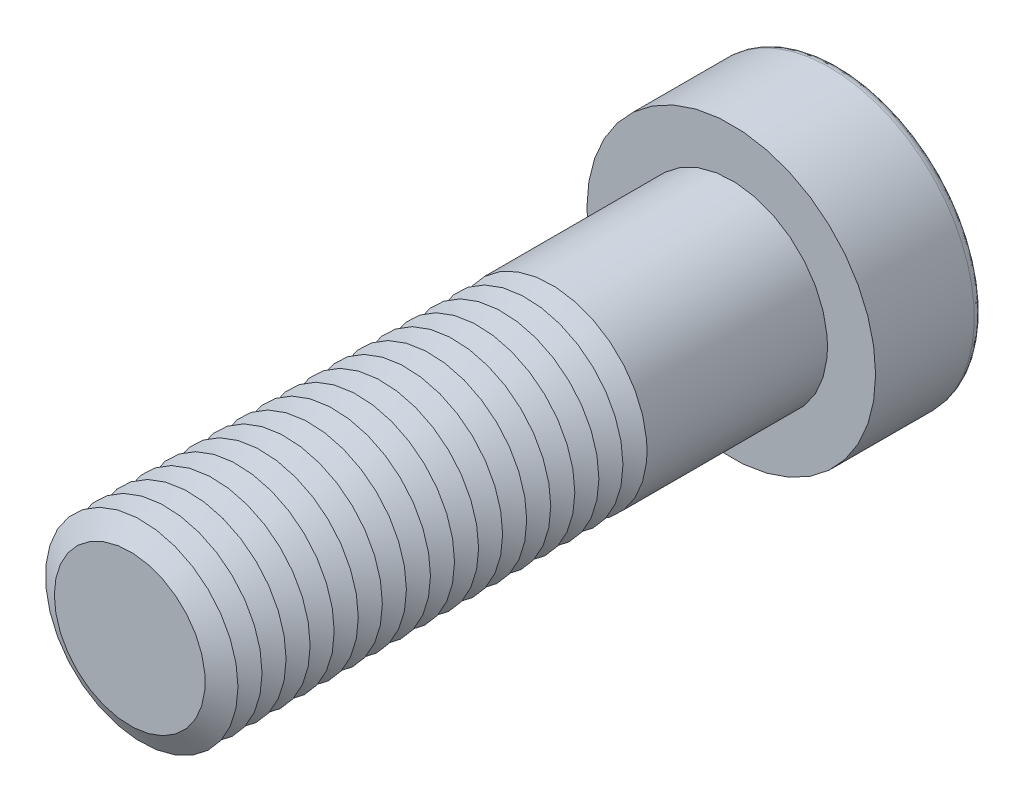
SolidWorks part; units mm, degrees
ref_plane "Front Plane" through (0, 0, 0) normal (0, 0, 1) x (1, 0, 0)
ref_plane "Top Plane" through (0, 0, 0) normal (0, 1, 0) x (1, 0, 0)
ref_plane "Right Plane" through (0, 0, 0) normal (1, 0, 0) x (0, 0, -1)
sketch "Sketch1" plane through (0, 0, 0) normal (0, 0, 1) x (1, 0, 0)
  circle A0 centre (0, 0) radius 8
  dimension "D1" = 16
extrude "Boss-Extrude1" add sketch "Sketch1" along normal blind 50
sketch "Sketch2" plane through (0, 0, 0) normal (0, 0, -1) x (-1, 0, 0)
  circle A0 centre (0, 0) radius 12
  dimension "D1" = 24
extrude "Boss-Extrude2" add sketch "Sketch2" along normal blind 9
sketch "Sketch3" plane through (0, 0, -9) normal (0, 0, -1) x (-1, 0, 0)
  line L1 (-3.4641, 6) -> (-6.9282, 0)
  line L2 (-6.9282, 0) -> (-3.4641, -6)
  line L3 (-3.4641, -6) -> (3.4641, -6)
  line L4 (3.4641, -6) -> (6.9282, 0)
  line L5 (6.9282, 0) -> (3.4641, 6)
  line L6 (3.4641, 6) -> (-3.4641, 6)
  circle A0 centre (0, 0) radius 6 construction
  dimension "D1" = 12
extrude "Cut-Extrude1" cut sketch "Sketch3" against normal blind 9
fillet "Fillet1" radius 0.8 1 edges at (-12, 0, -9)
sketch "Sketch4" plane through (0, 0, 0) normal (0, 0, -1) x (-1, 0, 0)
  line L0 (3.4641, -6) -> (6.9282, 0) construction
  circle A0 centre (0, 0) radius 6
extrude "Cut-Extrude2" cut sketch "Sketch4" against normal through all draft 60
sketch "Sketch5" plane through (0, 0, -9) normal (0, 0, -1) x (-1, 0, 0)
  circle A0 centre (0, 0) radius 6.9282
extrude "Cut-Extrude3" cut sketch "Sketch5" against normal through all draft 75
sketch "Sketch7" plane through (0, 0, 0) normal (1, 0, 0) x (0, 0, -1)
  line L25 (-50, 6.2679) -> (-49, 8)
  line L26 (-50, 8) -> (-50, -8) construction
  line L27 (-49, 8) -> (-51, 8)
  line L28 (-51, 8) -> (-50, 6.2679)
  line L29 (0, 8) -> (-50, 8) construction
  dimension "D1" = 2
revolve "Cut-Revolve1" cut sketch "Sketch7" angle 360 about axis through (0, 0, 50) along (0, 0, -1)
pattern_linear "LPattern1" count 18 spacing 2 along (0, 0, -1) of "Cut-Revolve1"
